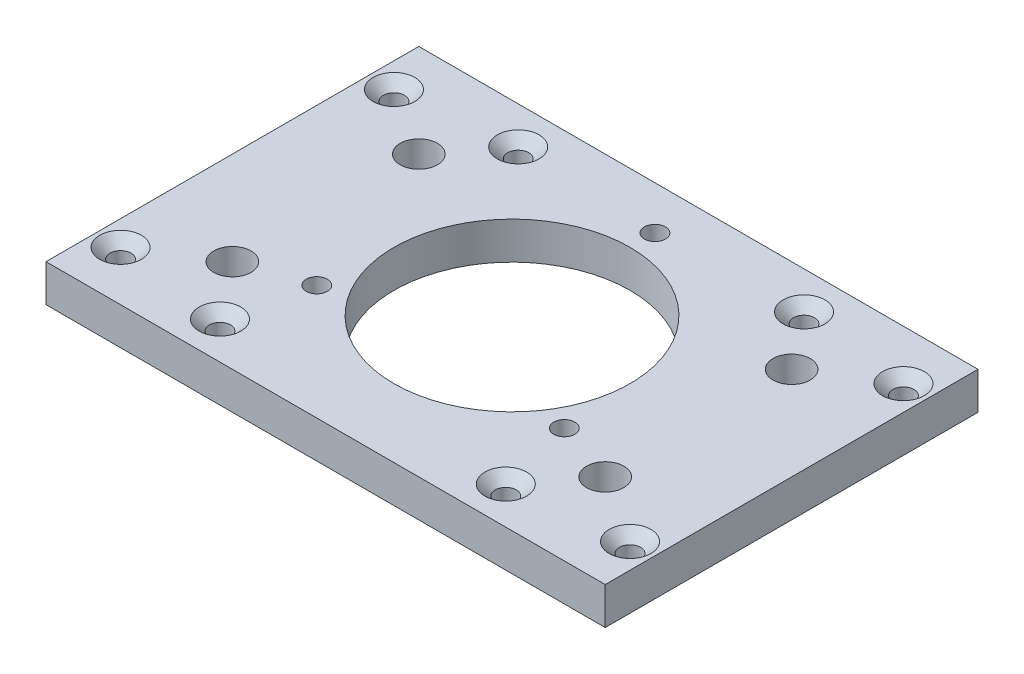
SolidWorks part; units mm, degrees
ref_plane "Front Plane" through (0, 0, 0) normal (0, 0, 1) x (1, 0, 0)
ref_plane "Top Plane" through (0, 0, 0) normal (0, 1, 0) x (1, 0, 0)
ref_plane "Right Plane" through (0, 0, 0) normal (1, 0, 0) x (0, 0, -1)
sketch "Sketch1" plane through (0, 0, 0) normal (1, 0, 0) x (0, 0, -1)
  line L1 (-30, -3) -> (30, -3)
  line L2 (-30, -3) -> (-30, 3)
  line L3 (-30, 3) -> (30, 3)
  line L4 (30, -3) -> (30, 3)
  line L5 (-30, -3) -> (30, 3) construction
  line L6 (-30, 3) -> (30, -3) construction
  point P0 (0, 0)
  dimension "D1" = 6
  dimension "D2" = 60
extrude "Boss-Extrude1" add sketch "Sketch1" along normal mid plane 90
sketch "Sketch2" plane through (0, 3, 0) normal (0, 1, 0) x (1, 0, 0)
  circle A0 centre (0, 0) radius 19
  dimension "D1" = 38
extrude "Cut-Extrude1" cut sketch "Sketch2" against normal through all
hole_wizard "CSK for M3 SFHCS3" positions "Sketch4" profile "Sketch3" countersink size "M3" standard "ANSI Metric"
sketch "Sketch4" plane through (0, 3, 0) normal (0, 1, 0) x (1, 0, 0)
  point P0 (-23, 24)
  point P3 (23, 24)
  point P6 (23, -24)
  point P9 (-23, -24)
sketch "Sketch3" plane through (-23, 3, -24) normal (1, 0, 0) x (0, 0, 1)
  line L0 (0, 0) -> (0, 6)
  line L1 (0, 6) -> (1.7, 6)
  line L2 (1.7, 6) -> (1.7, 1.66)
  line L3 (1.7, 1.66) -> (3.36, 0)
  line L5 (3.36, 0) -> (0, 0)
  line L6 (-1.7, 1.66) -> (-3.36, 0) construction
  line L11 (0, -6.35) -> (0, 107.95) construction
  dimension "Thru Hole Dia." = 3.4
  dimension "Thru Hole Depth" = 6
  dimension "Near C'Sink Dia." = 6.72
  dimension "Near C'Sink Angle" = 90
hole_wizard "CSK for M3 SFHCS2" positions "Sketch6" profile "Sketch5" countersink size "M3" standard "ANSI Metric"
sketch "Sketch6" plane through (0, 3, 0) normal (0, 1, 0) x (1, 0, 0)
  point P0 (-41, 22)
  point P3 (41, 22)
  point P6 (41, -22)
  point P9 (-41, -22)
sketch "Sketch5" plane through (-41, 3, -22) normal (1, 0, 0) x (0, 0, 1)
  line L0 (0, 0) -> (0, 6)
  line L1 (0, 6) -> (1.7, 6)
  line L2 (1.7, 6) -> (1.7, 1.66)
  line L3 (1.7, 1.66) -> (3.36, 0)
  line L5 (3.36, 0) -> (0, 0)
  line L6 (-1.7, 1.66) -> (-3.36, 0) construction
  line L11 (0, -6.35) -> (0, 107.95) construction
  dimension "Thru Hole Dia." = 3.4
  dimension "Thru Hole Depth" = 6
  dimension "Near C'Sink Dia." = 6.72
  dimension "Near C'Sink Angle" = 90
hole_wizard "CSK for M3 SFHCS1" positions "Sketch8" profile "Sketch7" countersink size "M3" standard "ANSI Metric"
sketch "Sketch8" plane through (0, -3, 0) normal (0, -1, 0) x (-1, 0, 0)
  point P0 (19.9186, -11.5)
  point P3 (-19.9186, -11.5)
  point P6 (0, 23)
sketch "Sketch7" plane through (-19.9186, -3, 11.5) normal (1, 0, 0) x (0, 0, -1)
  line L0 (0, 0) -> (0, 6)
  line L1 (0, 6) -> (1.7, 6)
  line L2 (1.7, 6) -> (1.7, 1.66)
  line L3 (1.7, 1.66) -> (3.36, 0)
  line L5 (3.36, 0) -> (0, 0)
  line L6 (-1.7, 1.66) -> (-3.36, 0) construction
  line L11 (0, -6.35) -> (0, 107.95) construction
  dimension "Thru Hole Dia." = 3.4
  dimension "Thru Hole Depth" = 6
  dimension "Near C'Sink Dia." = 6.72
  dimension "Near C'Sink Angle" = 90
hole_wizard "Ø6.0 (6) Diameter Hole1" positions "Sketch10" profile "Sketch9" hole size "Ø6.0" standard "ANSI Metric"
sketch "Sketch10" plane through (0, 3, 0) normal (0, 1, 0) x (1, 0, 0)
  point P0 (-30, 15)
  point P3 (-30, -15)
  point P6 (30, -15)
  point P9 (30, 15)
sketch "Sketch9" plane through (-30, 3, -15) normal (1, 0, 0) x (0, 0, 1)
  line L0 (0, 0) -> (0, 6)
  line L1 (0, 6) -> (3, 6)
  line L2 (3, 6) -> (3, 0)
  line L5 (3, 0) -> (0, 0)
  line L11 (0, -6.35) -> (0, 107.95) construction
  dimension "Thru Hole Dia." = 6
  dimension "Thru Hole Depth" = 6
